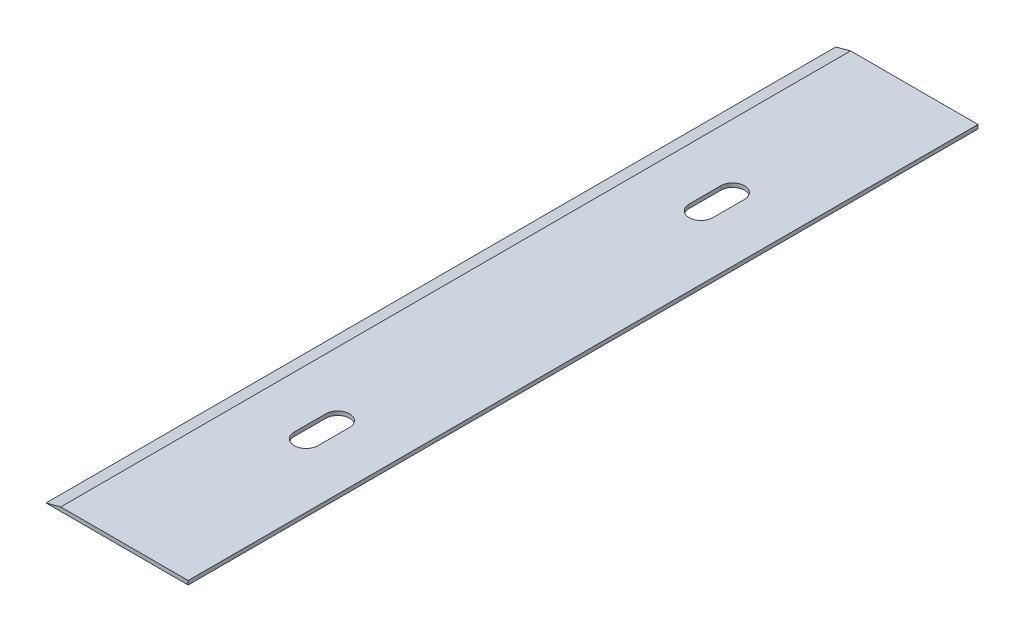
SolidWorks part; units mm, degrees
ref_plane "Alzado" through (0, 0, 0) normal (0, 0, 1) x (1, 0, 0)
ref_plane "Planta" through (0, 0, 0) normal (0, 1, 0) x (1, 0, 0)
ref_plane "Vista lateral" through (0, 0, 0) normal (1, 0, 0) x (0, 0, -1)
sketch "Croquis1" plane through (0, 0, 0) normal (0, 0, 1) x (1, 0, 0)
  line L0 (0, 0) -> (1.866, 0.5)
  line L1 (1.866, 0.5) -> (18, 0.5)
  line L2 (18, 0.5) -> (18, 0)
  line L3 (18, 0) -> (0, 0)
  point P3 (1.8807, 0.5)
  dimension "D1" = 0.5
  dimension "D2" = 18
  dimension "D3" = 15
extrude "Saliente-Extruir1" add sketch "Croquis1" against normal blind 100
sketch "Croquis2" plane through (0, 0.5, 0) normal (0, 1, 0) x (1, 0, 0)
  line L0 (9.933, 77) -> (9.933, 73) construction
  line L1 (11.433, 77) -> (11.433, 73)
  line L2 (8.433, 77) -> (8.433, 73)
  line L3 (18, 100) -> (1.866, 100) construction
  arc A0 (11.433, 77) -> (8.433, 77) centre (9.933, 77) ccw
  arc A1 (8.433, 73) -> (11.433, 73) centre (9.933, 73) ccw
  point P2 (9.933, 75)
  point P9 (9.933, 100)
  dimension "D2" = 1.5
  dimension "D1" = 4
  dimension "D3" = 25
extrude "Cortar-Extruir1" cut sketch "Croquis2" against normal through all
ref_plane "Plano4" through (0, 0, -50) normal (0, 0, 1) x (1, 0, 0)
mirror "Simetría1" about plane through (0, 0, -50) normal (0, 0, 1) of "Cortar-Extruir1"
